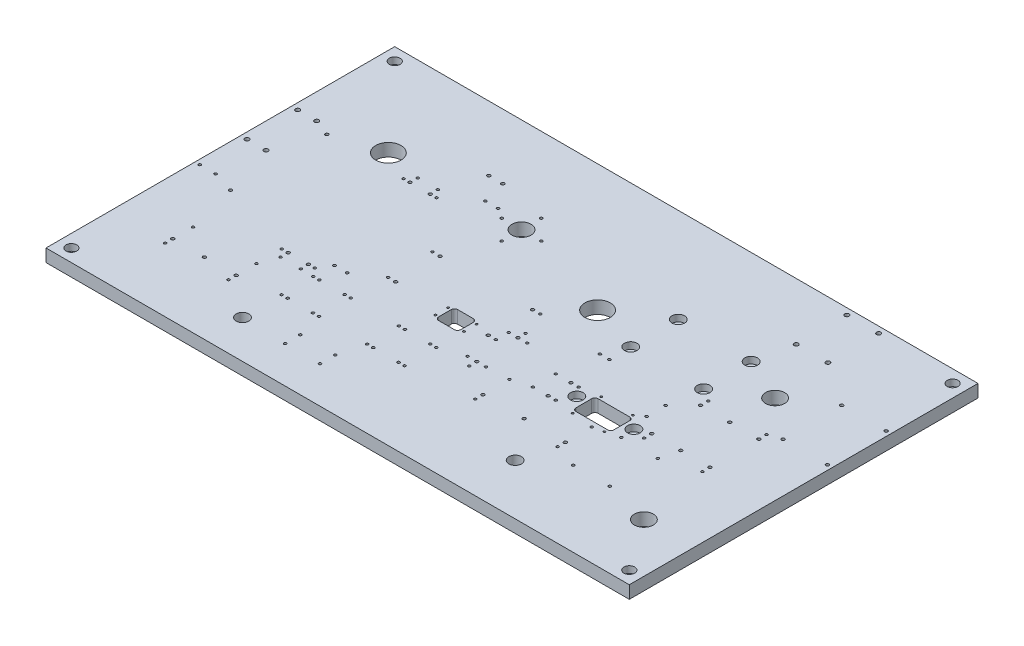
SolidWorks part; units mm, degrees
ref_plane "前视基准面" through (0, 0, 0) normal (0, 0, 1) x (1, 0, 0)
ref_plane "上视基准面" through (0, 0, 0) normal (0, 1, 0) x (1, 0, 0)
ref_plane "右视基准面" through (0, 0, 0) normal (1, 0, 0) x (0, 0, -1)
sketch "草图1" plane through (0, 0, 0) normal (0, 0, 1) x (1, 0, 0)
  line L0 (0, 20) -> (920, 20)
  line L1 (0, 0) -> (920, 0)
  line L2 (0, 0) -> (0, 20)
  line L3 (920, 0) -> (920, 20)
extrude "凸台-拉伸1" add sketch "草图1" along normal blind 550
sketch "草图2" plane through (0, 20, 0) normal (0, 1, 0) x (1, 0, 0)
  line L0 (641.25, -355.5) -> (691.25, -355.5)
  line L1 (636.25, -350.5) -> (636.25, -325.5)
  line L2 (696.25, -350.5) -> (696.25, -325.5)
  line L3 (641.25, -320.5) -> (691.25, -320.5)
  line L4 (408.7, -309.5) -> (433.7, -309.5)
  line L5 (408.7, -339.5) -> (433.7, -339.5)
  line L6 (403.7, -334.5) -> (403.7, -314.5)
  line L7 (438.7, -334.5) -> (438.7, -314.5)
  circle A0 centre (32.5, -315) radius 2.1
  circle A1 centre (7.5, -315) radius 2.1
  circle A2 centre (66.45, -325.4284) radius 2.5
  circle A3 centre (66.45, -173.4284) radius 2.5
  circle A4 centre (229.45, -173.4284) radius 2.5
  circle A5 centre (197.45, -173.4284) radius 2.5
  circle A6 centre (229.45, -365.5) radius 2.5
  circle A7 centre (197.45, -365.5) radius 2.5
  circle A8 centre (272.45, -102) radius 2.5
  circle A9 centre (250.45, -102) radius 2.5
  circle A10 centre (302.45, -139.4284) radius 2.1
  circle A11 centre (282.45, -139.4284) radius 2.1
  circle A12 centre (251.45, -346.4284) radius 2.1
  circle A13 centre (271.45, -346.4284) radius 2.1
  circle A14 centre (322, -250.5) radius 2.5
  circle A15 centre (322, -320.5) radius 2.5
  circle A16 centre (468, -250.5) radius 2.5
  circle A17 centre (468, -320.5) radius 2.5
  circle A18 centre (494.9, -300.5) radius 2.5
  circle A19 centre (494.9, -365.5) radius 2.5
  circle A20 centre (598, -320) radius 2.5
  circle A21 centre (598, -356) radius 2.5
  circle A22 centre (731.25, -248.8) radius 2.5
  circle A23 centre (777.25, -248.8) radius 2.5
  circle A24 centre (823.25, -248.8) radius 2.5
  circle A25 centre (823.25, -326) radius 2.5
  circle A26 centre (777.25, -326) radius 2.5
  circle A27 centre (731.25, -326) radius 2.5
  circle A28 centre (842.5, -230) radius 2.5
  circle A29 centre (912.5, -230) radius 2.5
  circle A30 centre (912.5, -137.5) radius 2.5
  circle A31 centre (842.5, -137.5) radius 2.5
  circle A32 centre (770, -355) radius 2.1
  circle A33 centre (712.5, -355) radius 2.1
  circle A34 centre (770, -431) radius 2.1
  circle A35 centre (712.5, -431) radius 2.1
  circle A36 centre (675, -406) radius 2.5
  circle A37 centre (610, -406) radius 2.5
  circle A38 centre (545, -406) radius 2.5
  circle A39 centre (434.2, -428.1) radius 2.1
  circle A40 centre (434.2, -378.1) radius 2.1
  circle A41 centre (394.2, -378.1) radius 2.1
  circle A42 centre (394.2, -428.1) radius 2.1
  circle A43 centre (299.2, -378.1) radius 2.1
  circle A44 centre (299.2, -428.1) radius 2.1
  circle A45 centre (259.2, -428.1) radius 2.1
  circle A46 centre (259.2, -378.1) radius 2.1
  circle A47 centre (187.4, -437.5) radius 2.5
  circle A48 centre (137.4, -437.5) radius 2.5
  circle A49 centre (87.4, -437.5) radius 2.5
  circle A50 centre (374.2, -468) radius 2.1
  circle A51 centre (374.2, -492) radius 2.1
  circle A52 centre (319.2, -492) radius 2.1
  circle A53 centre (319.2, -468) radius 2.1
  circle A54 centre (621.25, -334) radius 3.25
  circle A55 centre (711.25, -334) radius 3.25
  circle A56 centre (711.25, -224) radius 3.25
  circle A57 centre (596.25, -224) radius 3.25
  circle A58 centre (596.25, -149) radius 3.25
  circle A59 centre (711.25, -149) radius 3.25
  circle A60 centre (596.75, -258.0819) radius 2.1
  circle A61 centre (581.75, -258.0819) radius 2.1
  circle A62 centre (703.75, -276.5) radius 2.1
  circle A63 centre (703.75, -306.5) radius 2.1
  circle A64 centre (40, -163) radius 3.375
  circle A65 centre (10, -163) radius 3.375
  circle A66 centre (40, -243) radius 3.375
  circle A67 centre (10, -243) radius 3.375
  circle A68 centre (773.25, -90) radius 3.375
  circle A69 centre (723.25, -90) radius 3.375
  circle A70 centre (723.25, -10) radius 3.375
  circle A71 centre (773.25, -10) radius 3.375
  circle A72 centre (318.75, -150) radius 2.1
  circle A73 centre (350, -181.25) radius 2.1
  circle A74 centre (381.25, -150) radius 2.1
  circle A75 centre (350, -118.75) radius 2.1
  circle A76 centre (398.7, -314.5) radius 1.65
  circle A77 centre (443.7, -314.5) radius 1.65
  circle A78 centre (443.7, -334.5) radius 1.65
  circle A79 centre (398.7, -334.5) radius 1.65
  circle A80 centre (641.25, -360.5) radius 1.65
  circle A81 centre (691.25, -360.5) radius 1.65
  circle A82 centre (691.25, -315.5) radius 1.65
  circle A83 centre (641.25, -315.5) radius 1.65
  arc A84 (636.25, -350.5) -> (641.25, -355.5) centre (641.25, -350.5) ccw
  arc A85 (691.25, -355.5) -> (696.25, -350.5) centre (691.25, -350.5) ccw
  arc A86 (696.25, -325.5) -> (691.25, -320.5) centre (691.25, -325.5) ccw
  arc A87 (641.25, -320.5) -> (636.25, -325.5) centre (641.25, -325.5) ccw
  circle A88 centre (350, -150) radius 15
  arc A89 (433.7, -339.5) -> (438.7, -334.5) centre (433.7, -334.5) ccw
  arc A90 (438.7, -314.5) -> (433.7, -309.5) centre (433.7, -314.5) ccw
  arc A91 (408.7, -309.5) -> (403.7, -314.5) centre (408.7, -314.5) ccw
  arc A92 (403.7, -334.5) -> (408.7, -339.5) centre (408.7, -334.5) ccw
  circle A93 centre (187.4, -405.5) radius 2
  circle A94 centre (87.4, -405.5) radius 2
  circle A95 centre (87.4, -449.5) radius 2
  circle A96 centre (187.4, -449.5) radius 2
  circle A97 centre (308.7, -378.1) radius 2
  circle A98 centre (308.7, -428.1) radius 2
  circle A99 centre (249.7, -428.1) radius 2
  circle A100 centre (249.7, -378.1) radius 2
  circle A101 centre (443.7, -428.1) radius 2
  circle A102 centre (443.7, -378.1) radius 2
  circle A103 centre (384.7, -378.1) radius 2
  circle A104 centre (384.7, -428.1) radius 2
  circle A105 centre (239.45, -365.5) radius 2
  circle A106 centre (187.45, -365.5) radius 2
  circle A107 centre (239.45, -173.4284) radius 2
  circle A108 centre (187.45, -173.4284) radius 2
  circle A109 centre (229.45, -377.5) radius 2
  circle A110 centre (197.45, -377.5) radius 2
  circle A111 centre (229.45, -161.4284) radius 2
  circle A112 centre (197.45, -161.4284) radius 2
  circle A113 centre (494.9, -288.5) radius 2
  circle A114 centre (494.9, -377.5) radius 2
  circle A115 centre (509.4, -300.5) radius 2
  circle A116 centre (509.4, -365.5) radius 2
  circle A117 centre (480.4, -365.5) radius 2
  circle A118 centre (574, -356) radius 2
  circle A119 centre (610, -356) radius 2
  circle A120 centre (610, -320) radius 2
  circle A121 centre (574, -320) radius 2
  circle A122 centre (675, -418) radius 2
  circle A123 centre (545, -418) radius 2
  circle A124 centre (545, -364) radius 2
  circle A125 centre (675, -364) radius 2
  circle A126 centre (731.25, -236.8) radius 2
  circle A127 centre (823.25, -236.8) radius 2
  circle A128 centre (823.25, -338) radius 2
  circle A129 centre (731.25, -338) radius 2
  circle A130 centre (310, -320.5) radius 2
  circle A131 centre (310, -250.5) radius 2
  circle A132 centre (480, -250.5) radius 2
  circle A133 centre (480, -320.5) radius 2
  circle A134 centre (20, -530) radius 5.25
  circle A135 centre (20, -20) radius 5.25
  circle A136 centre (900, -20) radius 5.25
  circle A137 centre (900, -530) radius 5.25
  circle A138 centre (250, -490) radius 10
  circle A139 centre (140, -150) radius 20
  circle A140 centre (520, -200) radius 20
  circle A141 centre (780, -180) radius 15
  circle A142 centre (660, -470) radius 10
  circle A144 centre (842.5, -449.5) radius 15
  dimension "D2" = 30
extrude "切除-拉伸2" cut sketch "草图2" against normal blind 550
sketch "草图3" plane through (0, 20, 0) normal (0, 1, 0) x (1, 0, 0)
  circle A0 centre (480.4, -300.5) radius 2
extrude "切除-拉伸3" cut sketch "草图3" against normal blind 550
sketch "草图4" plane through (0, 20, 0) normal (0, 1, 0) x (1, 0, 0)
  circle A0 centre (20, -530) radius 8.5
  circle A1 centre (20, -20) radius 8.5
  circle A2 centre (900, -20) radius 8.5
  circle A3 centre (900, -530) radius 8.5
extrude "切除-拉伸4" cut sketch "草图4" against normal blind 10.5
sketch "草图5" plane through (0, 20, 0) normal (0, 1, 0) x (1, 0, 0)
  circle A0 centre (596.25, -149) radius 10
  circle A1 centre (711.25, -149) radius 10
  circle A2 centre (711.25, -224) radius 10
  circle A3 centre (596.25, -224) radius 10
  circle A4 centre (621.25, -334) radius 10
  circle A5 centre (711.25, -334) radius 10
extrude "切除-拉伸5" cut sketch "草图5" against normal blind 10.5
sketch "草图6" plane through (0, 20, 0) normal (0, 1, 0) x (1, 0, 0)
  circle A0 centre (621.25, -334) radius 5.5 construction
  circle A1 centre (711.25, -334) radius 5.5 construction
  circle A2 centre (711.25, -224) radius 5.5 construction
  circle A3 centre (596.25, -224) radius 5.5 construction
  circle A4 centre (596.25, -149) radius 5.5 construction
  circle A5 centre (711.25, -149) radius 5.5 construction
sketch "草图7" plane through (0, 0, 0) normal (0, -1, 0) x (1, 0, 0)
  circle A0 centre (621.25, 334) radius 5.5
  circle A1 centre (711.25, 334) radius 5.5
  circle A2 centre (711.25, 224) radius 5.5
  circle A3 centre (596.25, 224) radius 5.4569
  circle A4 centre (596.25, 149) radius 5.5
  circle A5 centre (711.25, 149) radius 5.5
extrude "切除-拉伸6" cut sketch "草图7" against normal blind 6.5
